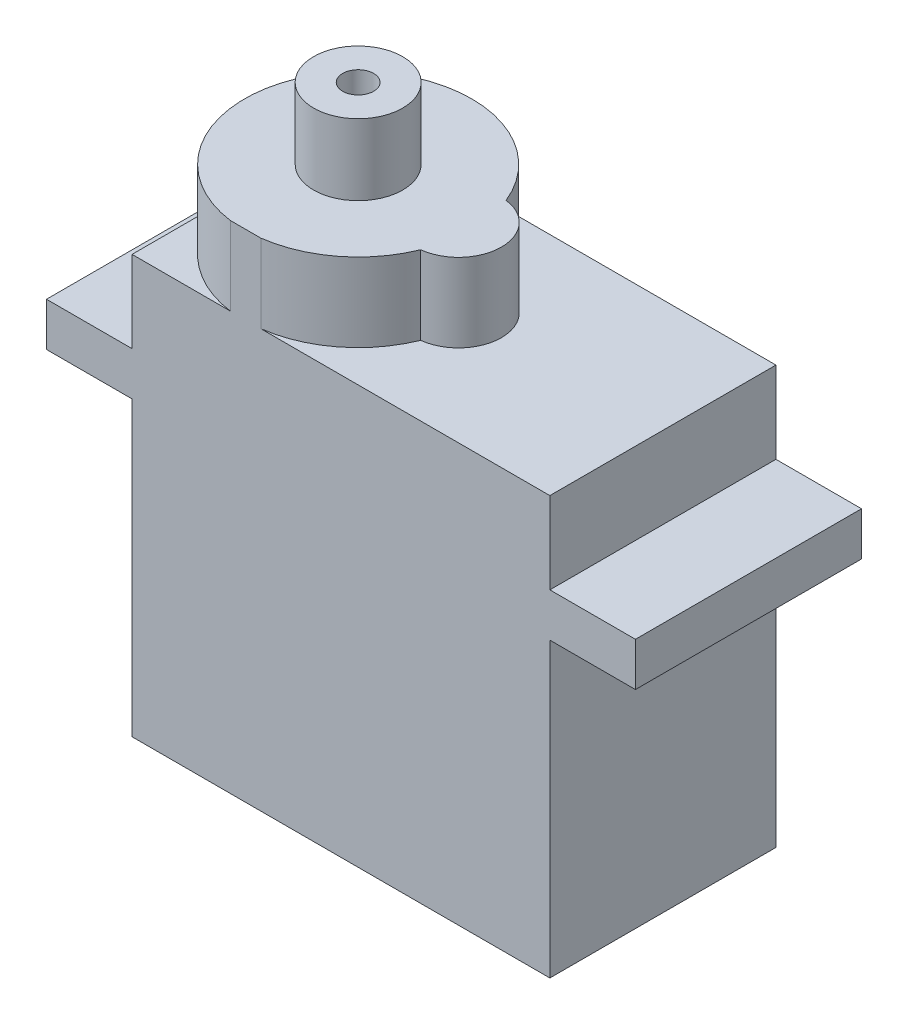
SolidWorks part; units mm, degrees
ref_plane "Front Plane" through (0, 0, 0) normal (0, 0, 1) x (1, 0, 0)
ref_plane "Top Plane" through (0, 0, 0) normal (0, 1, 0) x (1, 0, 0)
ref_plane "Right Plane" through (0, 0, 0) normal (1, 0, 0) x (0, 0, -1)
sketch "Sketch1" plane through (0, 0, 0) normal (0, 0, 1) x (1, 0, 0)
  line L1 (-16.7887, 19.3155) -> (5.5713, 19.3155)
  line L2 (-16.7887, 19.3155) -> (-16.7887, -3.0445)
  line L3 (-16.7887, -3.0445) -> (5.5713, -3.0445)
  line L4 (5.5713, 19.3155) -> (5.5713, -3.0445)
  dimension "D1" = 22.36
  dimension "D2" = 22.36
extrude "Boss-Extrude1" add sketch "Sketch1" along normal blind 12.1
sketch "Sketch2" plane through (5.5713, 0, 0) normal (1, 0, 0) x (0, 0, -1)
  line L0 (-12.1, -3.0445) -> (-12.1, 19.3155) construction
  line L1 (-12.1, 14.9455) -> (0, 14.9455)
  line L2 (-12.1, 14.9455) -> (-12.1, 12.6155)
  line L3 (-12.1, 12.6155) -> (0, 12.6155)
  line L4 (0, 14.9455) -> (0, 12.6155)
  line L5 (0, -3.0445) -> (0, 19.3155) construction
  line L7 (-12.1, 19.3155) -> (0, 19.3155) construction
  dimension "D1" = 6.7
  dimension "D2" = 2.33
extrude "Boss-Extrude2" add sketch "Sketch2" along normal blind 4.58
sketch "Sketch5" plane through (-16.7887, 0, 0) normal (-1, 0, 0) x (0, 0, 1)
  line L0 (0, 19.3155) -> (0, -3.0445) construction
  line L1 (0, 14.9455) -> (12.1, 14.9455)
  line L2 (0, 14.9455) -> (0, 12.6155)
  line L3 (0, 12.6155) -> (12.1, 12.6155)
  line L4 (12.1, 14.9455) -> (12.1, 12.6155)
  line L5 (12.1, 19.3155) -> (12.1, -3.0445) construction
  line L6 (12.1, 19.3155) -> (0, 19.3155) construction
  dimension "D1" = 6.7
  dimension "D2" = 2.33
extrude "Boss-Extrude5" add sketch "Sketch5" along normal blind 4.58
sketch "Sketch7" plane through (0, 19.3155, 0) normal (0, 1, 0) x (1, 0, 0)
  line L0 (-16.7887, -12.1) -> (-16.7887, 0) construction
  line L1 (5.5713, 0) -> (-16.7887, 0) construction
  circle A0 centre (-10.7113, -6.0773) radius 6.0773
  arc A1 (-5.0799, -8.3624) -> (-5.0799, -3.7923) centre (-5.3415, -6.0773) ccw
extrude "Boss-Extrude6" add sketch "Sketch7" along normal blind 4.2 contours A0 M6 | A0 A1
sketch "Sketch8" plane through (0, 23.5155, 0) normal (0, 1, 0) x (1, 0, 0)
  line L1 (-11.5247, -12.1) -> (-9.8979, -12.1)
  line L2 (-11.5247, -12.1) -> (-9.8979, -12.1)
  circle A0 centre (-10.7113, -6.0773) radius 2.385
  arc A3 (-9.8979, -12.1) -> (-5.0799, -8.3624) centre (-10.7113, -6.0773) ccw
  arc A4 (-5.0799, -8.3624) -> (-5.0799, -3.7923) centre (-5.3415, -6.0773) ccw
  arc A5 (-5.0799, -3.7923) -> (-11.5247, -12.1) centre (-10.7113, -6.0773) ccw
  arc A6 (-9.8979, -12.1) -> (-5.0799, -8.3624) centre (-10.7113, -6.0773) ccw
  arc A7 (-5.0799, -8.3624) -> (-5.0799, -3.7923) centre (-5.3415, -6.0773) ccw
  arc A8 (-5.0799, -3.7923) -> (-11.5247, -12.1) centre (-10.7113, -6.0773) ccw
  dimension "D1" = 0
extrude "Boss-Extrude7" add sketch "Sketch8" along normal blind 3.8 contours A0
sketch "Sketch9" plane through (0, 27.3155, 0) normal (0, 1, 0) x (1, 0, 0)
  circle A0 centre (-10.7113, -6.0773) radius 0.83
  circle A1 centre (-10.7113, -6.0773) radius 2.385
  circle A2 centre (-10.7113, -6.0773) radius 2.385
  dimension "D1" = 0
extrude "Cut-Extrude1" cut sketch "Sketch9" against normal blind 4.05 contours A0
